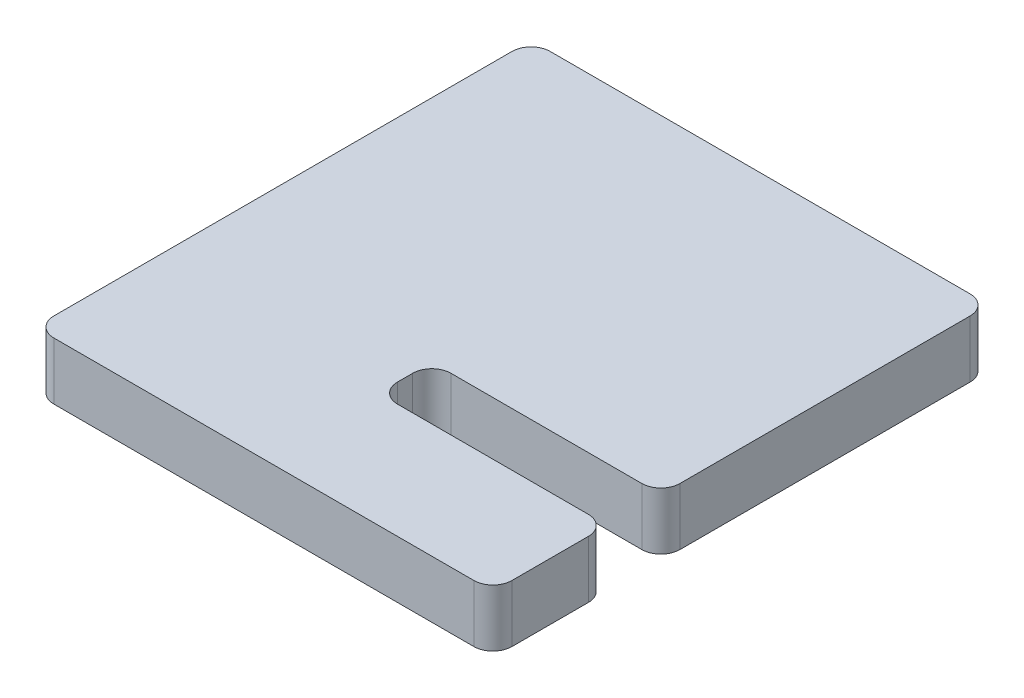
SolidWorks part; units mm, degrees
ref_plane "Front Plane" through (0, 0, 0) normal (0, 0, 1) x (1, 0, 0)
ref_plane "Top Plane" through (0, 0, 0) normal (0, 1, 0) x (1, 0, 0)
ref_plane "Right Plane" through (0, 0, 0) normal (1, 0, 0) x (0, 0, -1)
sketch "Sketch1" plane through (0, 0, 0) normal (0, 1, 0) x (1, 0, 0)
  line L0 (12, -7) -> (12, -13)
  line L1 (12, 13) -> (-12, 13)
  line L2 (12, 13) -> (12, -4.2)
  line L3 (12, -13) -> (-12, -13)
  line L4 (-12, 13) -> (-12, -13)
  line L5 (12, 13) -> (-12, -13) construction
  line L6 (12, -13) -> (-12, 13) construction
  line L7 (0, -7) -> (12, -7)
  line L8 (0, -7) -> (0, -4.2)
  line L9 (0, -4.2) -> (12, -4.2)
  line L11 (0, -7) -> (12, -4.2) construction
  line L12 (0, -4.2) -> (12, -7) construction
  point P0 (0, 0)
  point P6 (6, -5.6)
  dimension "D1" = 24
  dimension "D2" = 26
  dimension "D3" = 2.8
  dimension "D4" = 12
  dimension "D5" = 6
extrude "Boss-Extrude1" add sketch "Sketch1" along normal blind 3
fillet "Fillet1" radius 1 8 edges at (-12, 1.5, -13) (12, 1.5, -13) (12, 1.5, 4.2) (0, 1.5, 4.2) (0, 1.5, 7) (12, 1.5, 7) (-12, 1.5, 13) (12, 1.5, 13)
